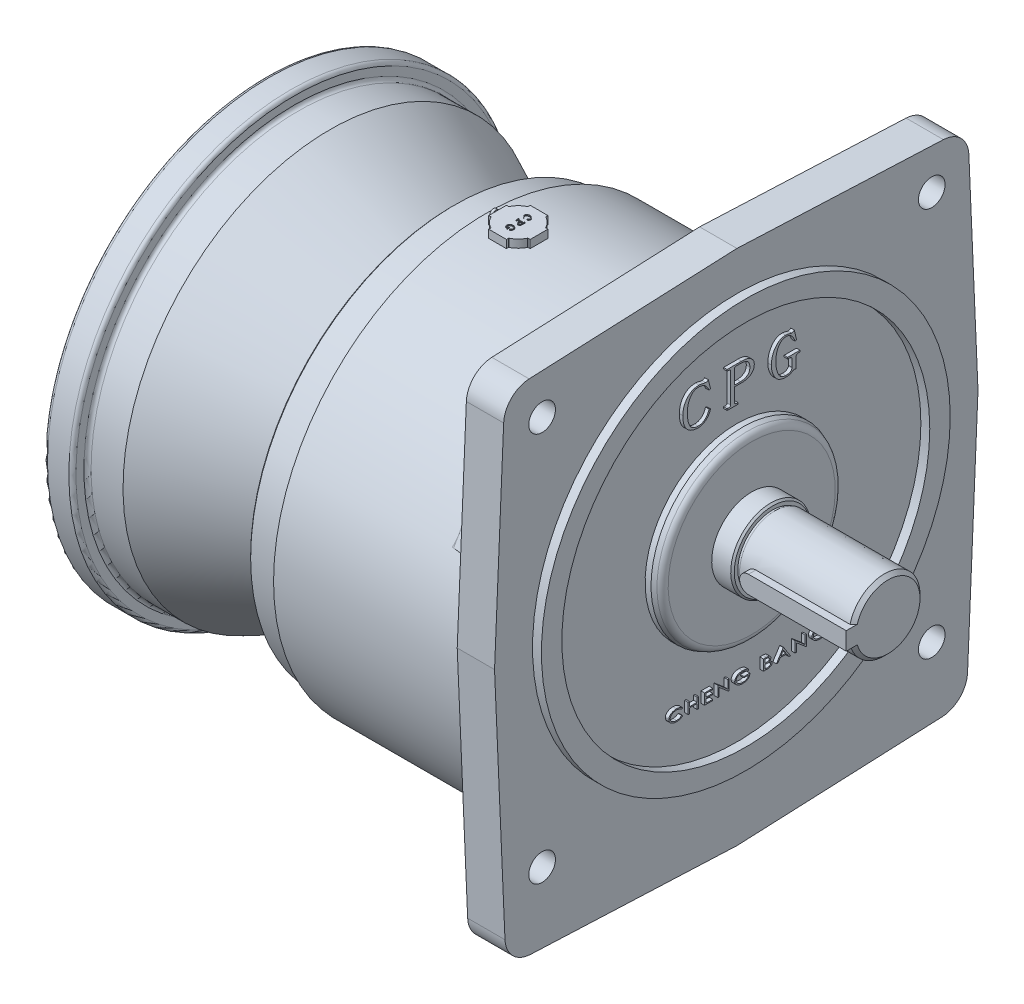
SolidWorks part; units mm, degrees
ref_plane "前基準面" through (0, 0, 0) normal (0, 0, 1) x (1, 0, 0)
ref_plane "上基準面" through (0, 0, 0) normal (0, 1, 0) x (1, 0, 0)
ref_plane "右基準面" through (0, 0, 0) normal (1, 0, 0) x (0, 0, -1)
sketch "草圖1" plane through (0, 0, 0) normal (0, 0, 1) x (1, 0, 0)
  line L0 (-0.0005, 119.7005) -> (-0.0005, 0)
  line L1 (-120, 119.7005) -> (-120, 113.7005)
  line L2 (-120, 119.7005) -> (-0.0005, 119.7005)
  line L3 (-120, 113.7005) -> (-121, 114.7005)
  line L4 (-120, 113.7005) -> (-121, 114.7005)
  line L5 (-120, 119.7005) -> (-120, 113.7005)
  line L6 (-120, 113.7005) -> (-121, 114.7005)
  line L7 (-120, 113.7005) -> (-121, 114.7005)
  line L9 (-138.9, 113.7005) -> (-138.9, 0)
  line L11 (-137.9, 114.7005) -> (-121, 114.7005)
  line L12 (-137.9, 114.7005) -> (-138.9, 113.7005)
  line L18 (-138.9, 0) -> (-0.0005, 0)
  line L28 (-430.8849, 0) -> (42.0523, 0) construction
revolve "旋轉1" add sketch "草圖1" angle 360 about L28
sketch "草圖6" plane through (0, 0, 0) normal (0, 0, 1) x (1, 0, 0)
  line L0 (-0.0005, 36) -> (149.3164, 36) construction
  line L1 (149.6, 0) -> (-149.6, 0) construction
  line L2 (106, 36) -> (19.3093, 36)
  line L3 (42.5, 56) -> (104, 56)
  line L4 (41, 57.5) -> (41, 55.5)
  line L5 (42.5, 56) -> (42.5, 55.5)
  line L6 (-0.0005, 119.7005) -> (-0.0005, 0) construction
  line L7 (24.3093, 87.6674) -> (19.3093, 87.6674)
  line L8 (106, 54) -> (106, 36)
  line L9 (29.3093, 83.006) -> (29.3093, 58.5)
  line L10 (40, 58.5) -> (29.3093, 58.5)
  line L11 (104, 56) -> (106, 54)
  line L12 (41, 57.5) -> (40, 58.5)
  line L13 (42.5, 55.5) -> (41, 55.5)
  line L14 (26.7333, 86.7439) -> (24.3093, 87.6674)
  line L16 (19.3093, 87.6674) -> (19.3093, 36)
  arc A5 (29.3093, 83.006) -> (26.7333, 86.7439) centre (25.3093, 83.006) ccw
  point P5 (106, 56)
  dimension "D1" = 36
  dimension "D2" = 65
  dimension "D3" = 40.0001
  dimension "D4" = 45.0001
revolve "旋轉3" add sketch "草圖6" angle 360 about L2
sketch "草圖8" plane through (-0.0005, 0, 0) normal (1, 0, 0) x (0, 0, -1)
  line L1 (0, 173) -> (-116.9067, 167.8957)
  line L2 (-131.2381, 153.5643) -> (-136.3711, 36)
  line L3 (-116.1631, -112.9282) -> (0, -118)
  line L4 (0, -118) -> (115.4194, -112.9607)
  line L5 (-136.3711, 36) -> (-130.4945, -98.5968)
  line L6 (116.1631, 167.9282) -> (0, 173)
  line L7 (130.4945, 153.5968) -> (135.6289, 36)
  line L8 (135.6289, 36) -> (129.7508, -98.6292)
  line L9 (0, 201.9695) -> (0, -167.8269) construction
  line L10 (164.2845, 36) -> (-222.6619, 36) construction
  arc A0 (-116.9067, 167.8957) -> (-131.2381, 153.5643) centre (-116.2524, 152.91) ccw
  arc A1 (130.4945, 153.5968) -> (116.1631, 167.9282) centre (115.5088, 152.9425) ccw
  arc A2 (115.4194, -112.9607) -> (129.7508, -98.6292) centre (114.7651, -97.975) ccw
  arc A3 (-130.4945, -98.5968) -> (-116.1631, -112.9282) centre (-115.5088, -97.9425) ccw
  circle A4 centre (0, 36) radius 155 construction
  circle A5 centre (109.6016, 145.6016) radius 7.5
  circle A6 centre (-109.6, 145.6031) radius 7.5
  circle A7 centre (-109.6016, -73.6016) radius 7.5
  circle A8 centre (109.6016, -73.6016) radius 7.5
  circle A9 centre (0, 36) radius 115 construction
  dimension "D3" = 15
  dimension "D14" = 310
  dimension "D16" = 15
  dimension "D5" = 15
  dimension "D6" = 15
  dimension "D11" = 15
  dimension "D9" = 230
  dimension "D2" = 291
  dimension "D4" = 175
  dimension "D7" = 109.6
  dimension "D13" = 272
ref_plane "平面1" through (0, 36, 0) normal (0, 1, 0) x (-1, 0, 0)
extrude "伸長9" add sketch "草圖8" along normal blind 21
sketch "草圖24" plane through (20.9995, 0, 0) normal (1, 0, 0) x (0, 0, -1)
  circle A0 centre (0, 36) radius 115
  circle A1 centre (0, 36) radius 103.5
  dimension "D1" = 230
  dimension "D2" = 207
extrude "伸長10" add sketch "草圖24" along normal blind 5
ref_plane "平面2" through (0, 0, 95) normal (0, 0, 1) x (1, 0, 0)
sketch "草圖30"
extrude "伸長17" add sketch "草圖30" along normal blind 2
sketch "草圖31" plane through (0, 0, 0) normal (0, 0, 1) x (1, 0, 0)
  line L0 (-0.0005, 153.5643) -> (-0.0005, 36) construction
  line L1 (-0.0005, 119.7005) -> (-120, 119.7005) construction
  arc A0 (-0.0005, 148.8668) -> (-31.4906, 119.7005) centre (-39.9341, 160.3994) cw
rib "肋材1" sketch "草圖31" sketch "草圖31" thickness 13 extrusion direction parallel to sketch draft on no parameters "D1"=13
pattern_circular "環狀複製排列1" count 6 over 360 about axis through (0, 0, 0) along (1, 0, 0) of "肋材1"
sketch "草圖32" plane through (0, 0, 0) normal (0, 0, 1) x (1, 0, 0)
  line L0 (-225.9, -116.5) -> (-207.9, -116.5)
  line L1 (-140.9, -91) -> (-153.4, -91)
  line L2 (-153.9, -91) -> (-207.9, -116.5)
  line L3 (-231.4, -32.5) -> (-232.9, -32.5)
  line L4 (-321.5954, 0) -> (-95.099, 0) construction
  line L5 (-153.4, -91) -> (-153.9, -91)
  line L6 (-138.9, 0) -> (-231.4, 0)
  line L8 (-138.9, -89) -> (-138.9, 0)
  line L9 (-0.0005, 36) -> (149.3164, 36) construction
  line L14 (-232.9, -49.0465) -> (-232.9, -32.5)
  line L15 (-193.5, -59.9307) -> (-231.3286, -51)
  line L16 (-238.9, -90) -> (-238.9, -78)
  line L18 (-227.9, -123) -> (-227.9, -118.5)
  line L19 (-241.9, -125) -> (-229.9, -125)
  line L20 (-243.9, -123) -> (-243.9, -90)
  line L21 (-193.5, -71.9894) -> (-193.5, -59.9307)
  line L22 (-238.9, -78) -> (-199.5, -78)
  line L23 (-243.9, -90) -> (-238.9, -90)
  line L24 (-231.4, -32.5) -> (-231.4, 0)
  arc A7 (-193.5, -71.9894) -> (-199.5, -78) centre (-199.5, -72) cw
  arc A8 (-138.9, -89) -> (-140.9, -91) centre (-140.9, -89) cw
  arc A9 (-227.9, -118.5) -> (-225.9, -116.5) centre (-225.9, -118.5) cw
  arc A10 (-227.9, -123) -> (-229.9, -125) centre (-229.9, -123) cw
  arc A11 (-241.9, -125) -> (-243.9, -123) centre (-241.9, -123) cw
  arc A13 (-231.3286, -51) -> (-232.9, -49.0465) centre (-230.9, -49.0465) cw
  dimension "D1" = 250
  dimension "D2" = 180
  dimension "D9" = 105
  dimension "D14" = 36
revolve "旋轉4" add sketch "草圖32" angle 360 about L4
sketch "草圖33" plane through (-243.9, 0, 0) normal (-1, 0, 0) x (0, 0, 1)
  circle A0 centre (0, 0) radius 107.5 construction
  circle A1 centre (-76.014, 76.014) radius 6
  circle A2 centre (76.014, 76.014) radius 6
  circle A3 centre (76.014, -76.014) radius 6
  circle A4 centre (-76.014, -76.014) radius 6
  dimension "D1" = 215
  dimension "D2" = 12
extrude "伸長18" cut sketch "草圖33" against normal blind 30
sketch "草圖34" plane through (-243.9, 0, 0) normal (-1, 0, 0) x (0, 0, 1)
  line L3 (-22.7172, 60.901) -> (-50.7937, 88.9775)
  line L6 (70.3748, -41.2181) -> (58.5646, -28.1991)
  line L8 (70.3748, 41.2181) -> (58.167, 29.0104)
  line L11 (41.2181, 70.3748) -> (29.0104, 58.167)
  line L13 (41.2181, -70.3748) -> (29.0104, -58.167)
  line L16 (-50.7937, -88.9775) -> (-22.7172, -60.901)
  line L18 (22.7172, -60.901) -> (50.7937, -88.9775)
  line L24 (-38.7361, -67.8928) -> (-29.0104, -58.167)
  line L36 (-29.0206, 58.1619) -> (-39.7711, 68.9869)
  line L37 (60.901, 22.7172) -> (88.9775, 50.7937)
  line L38 (-70.3748, 41.2181) -> (-58.167, 29.0104)
  line L39 (-67.8928, -38.7361) -> (-58.167, -29.0104)
  line L40 (-88.9775, 50.7937) -> (-60.901, 22.7172)
  line L41 (-60.901, -22.7172) -> (-88.9775, -50.7937)
  line L42 (50.7937, 88.9775) -> (22.7172, 60.901)
  line L43 (88.9775, -50.7937) -> (60.901, -22.7172)
  arc A13 (48.7703, -75.6403) -> (75.6403, -48.7703) centre (41.5234, -41.5234) ccw
  arc A14 (-48.7703, -75.6403) -> (-38.7361, -67.8928) centre (-65.4682, -43.6427) ccw
  arc A15 (88.9775, 50.7937) -> (92.1469, 50.3383) centre (90.3917, 49.3795) cw
  arc A16 (-88.9775, -50.7937) -> (-92.1469, -50.3383) centre (-90.3917, -49.3795) cw
  arc A17 (29.0104, -58.167) -> (58.5646, -28.1991) centre (0, 0) ccw
  arc A20 (75.6403, 48.7703) -> (48.7703, 75.6403) centre (41.5234, 41.5234) ccw
  arc A23 (60.901, -22.7172) -> (60.901, 22.7172) centre (0, 0) ccw
  arc A27 (92.1469, -50.3383) -> (92.1469, 50.3383) centre (0, 0) ccw
  arc A30 (-75.6403, -48.7703) -> (-48.7703, -75.6403) centre (-41.5234, -41.5234) ccw
  arc A33 (-50.7937, -88.9775) -> (-50.3383, -92.1469) centre (-49.3795, -90.3917) ccw
  arc A37 (48.7703, 75.6403) -> (41.2181, 70.3748) centre (65.4682, 43.6427) ccw
  arc A40 (75.6403, 48.7703) -> (70.3748, 41.2181) centre (43.6427, 65.4682) cw
  arc A72 (75.6403, -48.7703) -> (70.3748, -41.2181) centre (43.6427, -65.4682) ccw
  arc A73 (-75.6403, -48.7703) -> (-67.8928, -38.7361) centre (-43.6427, -65.4682) cw
  arc A74 (-58.167, -29.0104) -> (-29.0104, -58.167) centre (0, 0) ccw
  arc A75 (48.7703, -75.6403) -> (41.2181, -70.3748) centre (65.4682, -43.6427) cw
  arc A76 (-48.7703, 75.6403) -> (-75.6403, 48.7703) centre (-41.5234, 41.5234) ccw
  arc A77 (58.167, 29.0104) -> (29.0104, 58.167) centre (0, 0) ccw
  arc A78 (-48.7703, 75.6403) -> (-39.7711, 68.9869) centre (-65.4682, 43.6427) cw
  arc A79 (-92.1469, 50.3383) -> (-92.1469, -50.3383) centre (0, 0) ccw
  arc A80 (-50.3383, -92.1469) -> (50.3383, -92.1469) centre (0, 0) ccw
  arc A81 (-29.0206, 58.1619) -> (-58.167, 29.0104) centre (0, 0) ccw
  arc A82 (-22.7172, -60.901) -> (22.7172, -60.901) centre (0, 0) ccw
  arc A83 (-50.7937, 88.9775) -> (-50.3383, 92.1469) centre (-49.3795, 90.3917) cw
  arc A84 (-75.6403, 48.7703) -> (-70.3748, 41.2181) centre (-43.6427, 65.4682) ccw
  arc A85 (-88.9775, 50.7937) -> (-92.1469, 50.3383) centre (-90.3917, 49.3795) ccw
  arc A86 (50.7937, 88.9775) -> (50.3383, 92.1469) centre (49.3795, 90.3917) ccw
  arc A87 (88.9775, -50.7937) -> (92.1469, -50.3383) centre (90.3917, -49.3795) ccw
  arc A88 (50.7937, -88.9775) -> (50.3383, -92.1469) centre (49.3795, -90.3917) cw
  arc A89 (-60.901, 22.7172) -> (-60.901, -22.7172) centre (0, 0) ccw
  arc A90 (22.7172, 60.901) -> (-22.7172, 60.901) centre (0, 0) ccw
  arc A91 (50.3383, 92.1469) -> (-50.3383, 92.1469) centre (0, 0) ccw
  dimension "D1" = 130
extrude "伸長19" cut sketch "草圖34" against normal blind 53
sketch "草圖35" plane through (-190.9, 0, 0) normal (-1, 0, 0) x (0, 0, 1)
  circle A0 centre (0, 0) radius 75 construction
  circle A1 centre (0, 75) radius 4.5
  circle A2 centre (53.033, 53.033) radius 4.5
  circle A3 centre (75, 0) radius 4.5
  circle A4 centre (53.033, -53.033) radius 4.5
  circle A5 centre (0, -75) radius 4.5
  circle A6 centre (-53.033, -53.033) radius 4.5
  circle A7 centre (-75, 0) radius 4.5
  circle A8 centre (-53.033, 53.033) radius 4.5
  dimension "D1" = 150
  dimension "D2" = 9
extrude "伸長20" cut sketch "草圖35" against normal blind 11
sketch "草圖36" plane through (-231.4, 0, 0) normal (-1, 0, 0) x (0, 0, 1)
  line L1 (4.6667, 13.1993) -> (4.6667, 17.2667)
  line L2 (0, -27.1353) -> (0, 27.1353) construction
  line L3 (-4.6667, 13.1993) -> (-4.6667, 17.2667)
  line L4 (-27.1353, 0) -> (27.1353, 0) construction
  line L5 (4.6667, 17.2667) -> (-4.6667, 17.2667)
  circle A0 centre (0, 0) radius 23.2167 construction
  arc A1 (-4.6667, 13.1993) -> (4.6667, 13.1993) centre (0, 0) ccw
extrude "伸長21" cut sketch "草圖36" against normal blind 58
sketch "草圖37" plane through (-231.4, 0, 0) normal (-1, 0, 0) x (0, 0, 1)
  line L0 (-4.6667, 13.1993) -> (-4.6667, 17.2667) construction
  line L1 (4.6667, 13.1993) -> (4.6667, 17.2667) construction
  line L2 (4.6667, 17.2667) -> (-4.6667, 17.2667) construction
  line L3 (-4.6667, 13.1993) -> (-4.6667, 17.2667)
  line L4 (4.6667, 13.1993) -> (4.6667, 17.2667)
  line L5 (4.6667, 17.2667) -> (-4.6667, 17.2667)
  arc A0 (-4.6667, 13.1993) -> (4.6667, 13.1993) centre (0, 0) ccw construction
  circle A1 centre (0, 0) radius 23.2167 construction
  arc A2 (-4.6667, 13.1993) -> (4.6667, 13.1993) centre (0, 0) ccw
  circle A3 centre (0, 0) radius 23.2167
extrude "伸長22" add sketch "草圖37" along normal blind 1
sketch "草圖38" plane through (0, 0, 0) normal (0, 0, 1) x (1, 0, 0)
  line L0 (172.3075, 36) -> (-0.0005, 36) construction
  line L1 (-0.0005, 36) -> (-0.0005, -98.5968) construction
  line L2 (-0.0005, 54.1328) -> (-0.0005, -116.8702) construction
  line L3 (106, 41) -> (51, 41)
  line L4 (106, 18) -> (106, 54) construction
  line L5 (51, 31) -> (106, 31)
  line L6 (106, 31) -> (106, 41)
  line L7 (46, 36) -> (46, 77.2087) construction
  line L8 (149.5, 36) -> (149.5, 82.6533) construction
  arc A0 (51, 41) -> (51, 31) centre (51, 36) ccw
  dimension "D1" = 20
  dimension "D2" = 10
  dimension "D3" = 5
  dimension "D4" = 60
  dimension "D5" = 43.5
extrude "伸長23" add sketch "草圖38" along normal blind 23.5
ref_plane "平面3" through (0, 124.2, 0) normal (0, 1, 0) x (-1, 0, 0)
sketch "草圖39" plane through (0, 124.2, 0) normal (0, 1, 0) x (-1, 0, 0)
  line L0 (97, 11.65) -> (107, 11.65)
  line L1 (97, 11.65) -> (97, 10.5119)
  line L2 (107, 11.65) -> (107, 10.5119)
  line L3 (97, -10.5119) -> (97, -11.65)
  line L4 (107, -10.5119) -> (107, -11.65)
  line L5 (90.35, 5) -> (91.4881, 5)
  line L6 (90.35, -5) -> (91.4881, -5)
  line L7 (90.35, -5) -> (90.35, 5)
  line L8 (97, -11.65) -> (97, -10.5119)
  line L9 (107, -11.65) -> (107, -10.5119)
  line L10 (107, -11.65) -> (97, -11.65)
  line L11 (113.65, -5) -> (112.5119, -5)
  line L12 (113.65, 5) -> (112.5119, 5)
  line L13 (113.65, 5) -> (113.65, -5)
  arc A0 (96.8617, 10.2882) -> (91.7118, 5.1383) centre (102, 0) ccw
  arc A1 (96.8617, 10.2882) -> (97, 10.5119) centre (96.75, 10.5119) ccw
  arc A2 (107, 10.5119) -> (107.1383, 10.2882) centre (107.25, 10.5119) ccw
  arc A3 (91.4881, 5) -> (91.7118, 5.1383) centre (91.4881, 5.25) ccw
  arc A4 (91.7118, -5.1383) -> (91.4881, -5) centre (91.4881, -5.25) ccw
  arc A5 (97, -10.5119) -> (96.8617, -10.2882) centre (96.75, -10.5119) ccw
  arc A6 (107.1383, -10.2882) -> (107, -10.5119) centre (107.25, -10.5119) ccw
  arc A7 (112.5119, -5) -> (112.2882, -5.1383) centre (112.5119, -5.25) ccw
  arc A8 (112.2882, 5.1383) -> (112.5119, 5) centre (112.5119, 5.25) ccw
  arc A9 (112.2882, 5.1383) -> (107.1383, 10.2882) centre (102, 0) ccw
  arc A10 (91.7118, -5.1383) -> (96.8617, -10.2882) centre (102, 0) ccw
  arc A11 (107.1383, -10.2882) -> (112.2882, -5.1383) centre (102, 0) ccw
extrude "伸長24" add sketch "草圖39" against normal blind 4.5 contours A6 A11 A7 L11 L13 L12 A8 A9 A2 L2 L0 L1 A1 A0 A3 L5 L7 L6 A4 A10 A5 L3 L10 L4
sketch "草圖40"
extrude "伸長25" add sketch "草圖40" along normal blind 0.5
sketch "草圖41" plane through (0, 0, 0) normal (0, 0, 1) x (1, 0, 0)
  line L0 (-116.0418, 121.95) -> (-108.0418, 121.95)
  line L1 (-116.0418, 121.95) -> (-116.0418, 123.95)
  line L2 (-114.5418, 123.2) -> (-114.5418, 123.95)
  line L13 (-112.5418, 123.2) -> (-108.0418, 122.95)
  line L15 (-114.5418, 123.2) -> (-112.5418, 123.2)
  line L23 (-116.0418, 123.95) -> (-114.5418, 123.95)
  line L24 (-112.5418, 121.95) -> (-112.5418, 123.2)
  line L25 (-108.0418, 121.95) -> (-108.0418, 122.95)
revolve "旋轉5" add sketch "草圖41" angle 360 about L0
equation "\"D4@草圖6\" = \"D3@草圖6\"+5"
equation "\"D1@伸長23\" = \"D5@草圖38\"-\"D3@草圖6\"/2"
equation "\"D1@草圖24\"=\"D2@草圖24\"+23"
